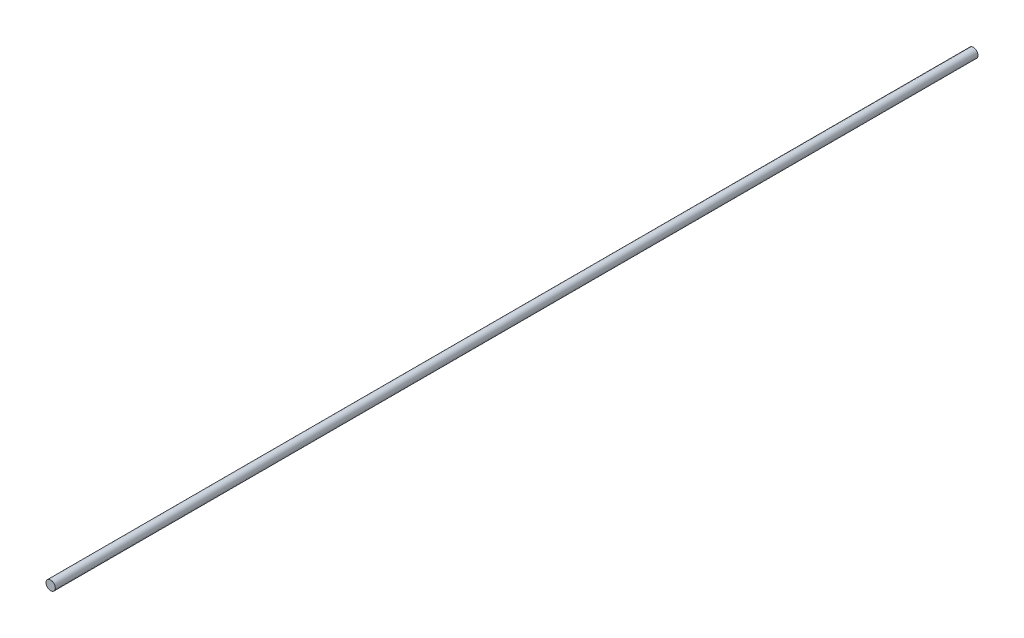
SolidWorks part; units mm, degrees
ref_plane "Front Plane" through (0, 0, 0) normal (0, 0, 1) x (1, 0, 0)
ref_plane "Top Plane" through (0, 0, 0) normal (0, 1, 0) x (1, 0, 0)
ref_plane "Right Plane" through (0, 0, 0) normal (1, 0, 0) x (0, 0, -1)
sketch "Sketch1" plane through (0, 0, 0) normal (0, 0, 1) x (1, 0, 0)
  circle A0 centre (0, 0) radius 30
  dimension "D1" = 60
extrude "Boss-Extrude1" add sketch "Sketch1" against normal blind 5950
